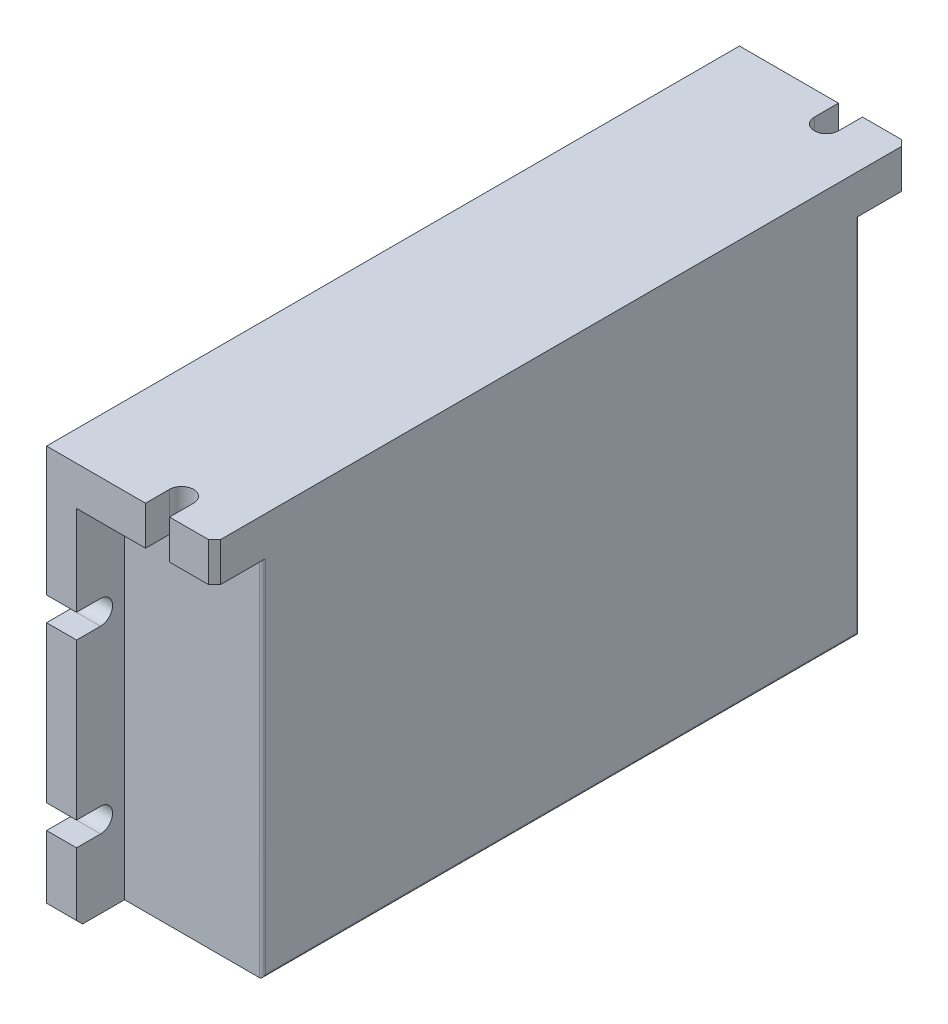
SolidWorks part; units mm, degrees
ref_plane "前视基准面" through (0, 0, 0) normal (0, 0, 1) x (1, 0, 0)
ref_plane "上视基准面" through (0, 0, 0) normal (0, 1, 0) x (1, 0, 0)
ref_plane "右视基准面" through (0, 0, 0) normal (1, 0, 0) x (0, 0, -1)
sketch "草图1" plane through (0, 0, 0) normal (1, 0, 0) x (0, 0, -1)
  line L1 (-57.75, -33.5) -> (57.75, -33.5)
  line L2 (-57.75, -33.5) -> (-57.75, 33.5)
  line L3 (-57.75, 33.5) -> (57.75, 33.5)
  line L4 (57.75, -33.5) -> (57.75, 33.5)
  line L5 (-57.75, -33.5) -> (57.75, 33.5) construction
  line L6 (-57.75, 33.5) -> (57.75, -33.5) construction
  point P0 (0, 0)
extrude "凸台-拉伸1" add sketch "草图1" along normal blind 28
sketch "草图2" plane through (28, 0, 0) normal (1, 0, 0) x (0, 0, -1)
  line L1 (-57.75, 33.5) -> (-57.75, -33.5) construction
  line L2 (-57.75, 27) -> (-49.75, 27)
  line L3 (-49.75, 27) -> (-49.75, -33.5)
  line L4 (-57.75, -33.5) -> (57.75, -33.5) construction
  line L5 (-49.75, -33.5) -> (-57.75, -33.5)
  line L6 (-57.75, -33.5) -> (-57.75, 27)
  line L8 (57.75, -33.5) -> (57.75, 33.5) construction
  line L9 (57.75, 27) -> (49.75, 27)
  line L10 (49.75, 27) -> (49.75, -33.5)
  line L11 (49.75, -33.5) -> (57.75, -33.5)
  line L12 (57.75, -33.5) -> (57.75, 27)
extrude "切除-拉伸1" cut sketch "草图2" against normal blind 23
sketch "草图3" plane through (0, 33.5, 0) normal (0, 1, 0) x (1, 0, 0)
  line L1 (28, 57.75) -> (0, 57.75) construction
  line L3 (16.5, 53.75) -> (16.5, 57.75)
  line L4 (16.5, 57.75) -> (20.5, 57.75)
  line L5 (20.5, 57.75) -> (20.5, 53.75)
  line L7 (28, -57.75) -> (0, -57.75) construction
  line L9 (16.5, -53.75) -> (16.5, -57.75)
  line L10 (16.5, -57.75) -> (20.5, -57.75)
  line L11 (20.5, -57.75) -> (20.5, -53.75)
  arc A0 (16.5, 53.75) -> (20.5, 53.75) centre (18.5, 53.75) ccw
  arc A1 (20.5, -53.75) -> (16.5, -53.75) centre (18.5, -53.75) ccw
extrude "切除-拉伸2" cut sketch "草图3" against normal blind 6.5
sketch "草图4" plane through (5, 0, 0) normal (1, 0, 0) x (0, 0, -1)
  line L1 (-57.75, 27) -> (-57.75, -33.5) construction
  line L3 (-53.75, -18) -> (-57.75, -18)
  line L4 (-57.75, -18) -> (-57.75, -22)
  line L5 (-57.75, -22) -> (-53.75, -22)
  line L8 (-53.75, 8) -> (-57.75, 8)
  line L9 (-57.75, 8) -> (-57.75, 12)
  line L10 (-57.75, 12) -> (-53.75, 12)
  line L12 (57.75, -33.5) -> (57.75, 27) construction
  line L14 (53.75, -18) -> (57.75, -18)
  line L15 (57.75, -18) -> (57.75, -22)
  line L16 (57.75, -22) -> (53.75, -22)
  line L18 (53.75, 12) -> (57.75, 12)
  line L19 (57.75, 12) -> (57.75, 8)
  line L20 (57.75, 8) -> (53.75, 8)
  arc A0 (-53.75, -22) -> (-53.75, -18) centre (-53.75, -20) ccw
  arc A1 (-53.75, 8) -> (-53.75, 12) centre (-53.75, 10) ccw
  arc A2 (53.75, -18) -> (53.75, -22) centre (53.75, -20) ccw
  arc A3 (53.75, 12) -> (53.75, 8) centre (53.75, 10) ccw
extrude "切除-拉伸3" cut sketch "草图4" against normal blind 5
fillet "圆角1" radius 0.5 3 edges at (28, -3.25, 49.75) (28, -3.25, -49.75) (28, -33.5, 0)
chamfer "倒角1" distance 1 angle 45 4 edges at (2.5, -33.5, -57.75) (2.5, -33.5, 57.75) (28, 30.25, -57.75) (28, 30.25, 57.75)
sketch "草图5" plane through (28, 0, 0) normal (1, 0, 0) x (0, 0, -1)
  text T0 "BLD-8" font "汉仪长仿宋体" height 5
